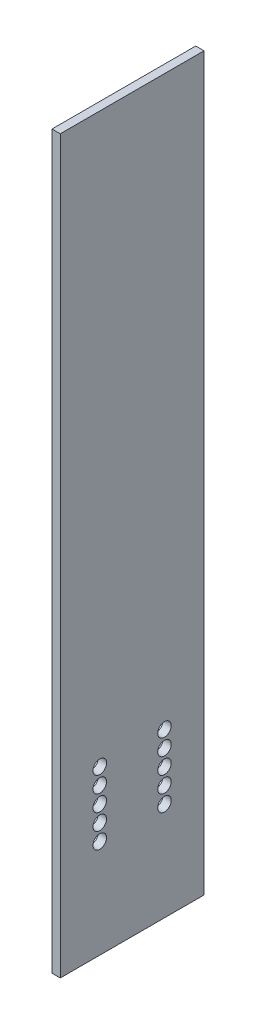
SolidWorks part; units mm, degrees
ref_plane "Front Plane" through (0, 0, 0) normal (0, 0, 1) x (1, 0, 0)
ref_plane "Top Plane" through (0, 0, 0) normal (0, 1, 0) x (1, 0, 0)
ref_plane "Right Plane" through (0, 0, 0) normal (1, 0, 0) x (0, 0, -1)
sketch "Sketch1" plane through (0, 0, 0) normal (1, 0, 0) x (0, 0, -1)
  line L1 (-28.2194, 143.51) -> (28.2194, 143.51)
  line L2 (-28.2194, 143.51) -> (-28.2194, -143.51)
  line L3 (-28.2194, -143.51) -> (28.2194, -143.51)
  line L4 (28.2194, 143.51) -> (28.2194, -143.51)
  line L5 (-28.2194, 143.51) -> (28.2194, -143.51) construction
  line L6 (-28.2194, -143.51) -> (28.2194, 143.51) construction
  point P0 (0, 0)
extrude "Boss-Extrude1" add sketch "Sketch1" along normal blind 3.2512
sketch "Sketch2" plane through (0, 0, 0) normal (-1, 0, 0) x (0, 0, 1)
  line L0 (0, 143.51) -> (0, -143.51) construction
  line L1 (-28.2194, 143.51) -> (28.2194, 143.51) construction
  line L2 (28.2194, -143.51) -> (-28.2194, -143.51) construction
  point P7 (-12.7, -98.5012)
  point P9 (12.7, -98.5012)
hole_wizard "#4 (0.209) Diameter Hole1" positions "Sketch3" profile "Sketch4" hole size "#4" standard "ANSI Inch"
sketch "Sketch3" plane through (0, 0, 0) normal (-1, 0, 0) x (0, 0, 1)
  point P0 (-12.7, -98.5012)
  point P3 (12.7, -98.5012)
sketch "Sketch4" plane through (0, -98.5012, -12.7) normal (0, 1, 0) x (0, 0, 1)
  line L0 (0, 0) -> (0, 3.2512)
  line L1 (0, 3.2512) -> (2.6543, 3.2512)
  line L2 (2.6543, 3.2512) -> (2.6543, 0)
  line L5 (2.6543, 0) -> (0, 0)
  line L11 (0, -6.35) -> (0, 107.95) construction
  dimension "Thru Hole Dia." = 5.3086
  dimension "Thru Hole Depth" = 3.2512
pattern_linear "LPattern1" count 4 spacing 6.35 along (0, 1, 0) count 2 spacing 6.35 along (0, -1, 0) of "#4 (0.209) Diameter Hole1"
equation "\"motor offset\"=6mm"
equation "\"thickness0.25\"=0.225in"
equation "\"thickness0.125\"=0.122in"
equation "\"thickness_acrylic0.1\"= 0.1in"
equation "\"D1@Sketch1\"=\"thickness_acrylic0.1\"+\"thickness0.125\"+2"
equation "\"D2@Sketch2\"=\"thickness0.125\"+0.5+1.15"
